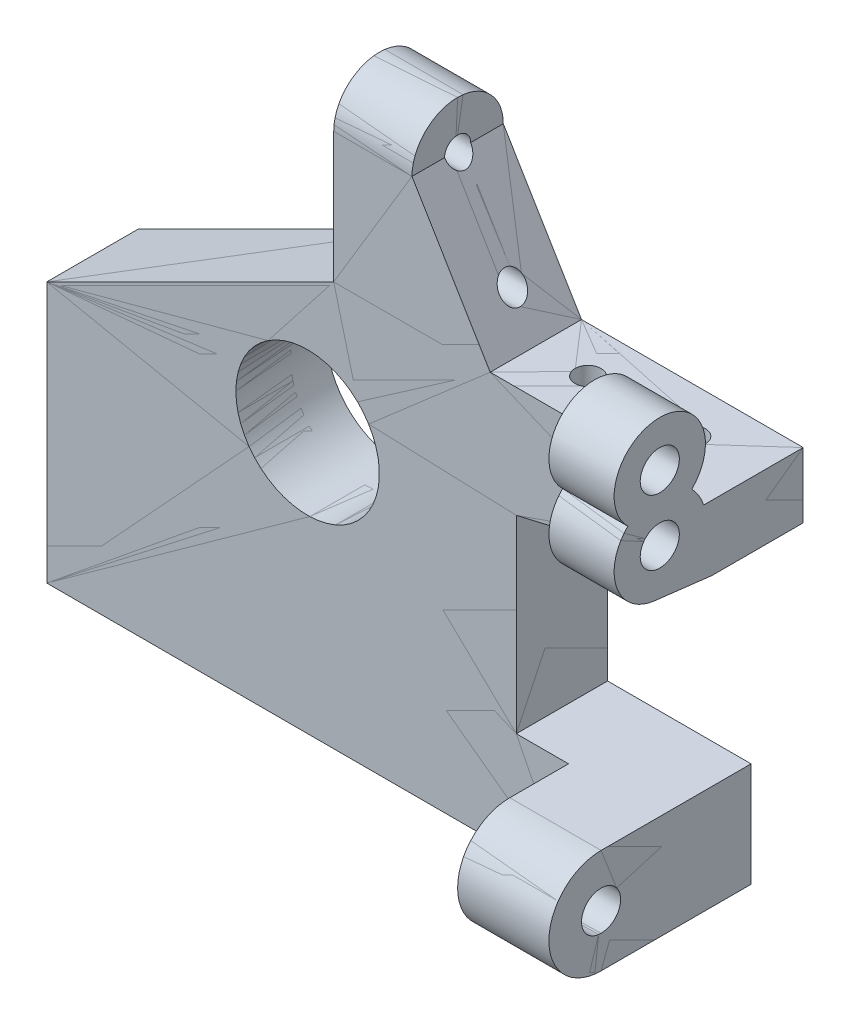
SolidWorks part; units mm, degrees
ref_plane "Plan1" through (0, 0, 0) normal (0, 0, 1) x (1, 0, 0)
ref_plane "Plan2" through (0, 0, 0) normal (0, 1, 0) x (1, 0, 0)
ref_plane "Plan3" through (0, 0, 0) normal (1, 0, 0) x (0, 0, -1)
imported_body "Importée1"
sketch "Esquisse2" plane through (0, 0, -7) normal (0, 0, -1) x (-1, 0, 0)
  line L0 (40, -10) -> (40, -30) construction
  circle A0 centre (20, -10) radius 7
  point P2 (40, -20)
  dimension "D1" = 14
extrude "Enlèv. mat.-Extru.1" cut sketch "Esquisse2" against normal blind 2.8
